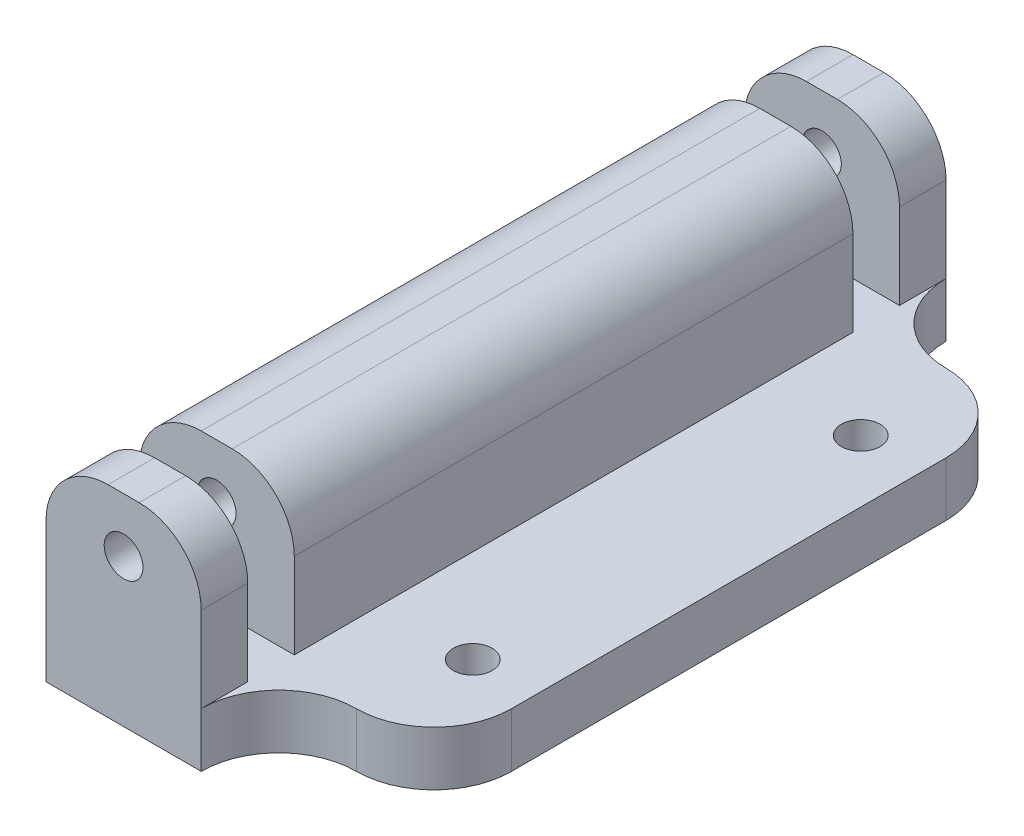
SolidWorks part; units mm, degrees
ref_plane "前视基准面" through (0, 0, 0) normal (0, 0, 1) x (1, 0, 0)
ref_plane "上视基准面" through (0, 0, 0) normal (0, 1, 0) x (1, 0, 0)
ref_plane "右视基准面" through (0, 0, 0) normal (1, 0, 0) x (0, 0, -1)
sketch "草图1" plane through (0, 0, 0) normal (0, 0, 1) x (1, 0, 0)
  line L0 (20, 3.5) -> (10, 3.5)
  line L1 (0, 0) -> (20, 0)
  line L2 (6, 13) -> (4, 13)
  line L3 (10, 3.5) -> (10, 9)
  line L4 (20, 0) -> (20, 3.5)
  line L5 (0, 9) -> (0, 0)
  arc A0 (0, 9) -> (4, 13) centre (4, 9) cw
  arc A1 (6, 13) -> (10, 9) centre (6, 9) cw
  point P10 (0, 13)
  dimension "D5" = 4
  dimension "D1" = 3.5
  dimension "D2" = 20
  dimension "D3" = 13
  dimension "D4" = 10
extrude "凸台-拉伸1" add sketch "草图1" along normal blind 48
sketch "草图3" plane through (0, 0, 0) normal (0, 0, -1) x (-1, 0, 0)
  line L0 (-6, 13) -> (-4, 13) construction
  circle A0 centre (-5, 9.5) radius 1
  dimension "D1" = 3.5
  dimension "D2" = 2
extrude "切除-拉伸2" cut sketch "草图3" against normal blind 60
sketch "草图4" plane through (0, 3.5, 0) normal (0, 1, 0) x (1, 0, 0)
  line L0 (20, -24) -> (10, -24) construction
  line L1 (20, -48) -> (20, 0) construction
  line L2 (10, -48) -> (10, 0) construction
  circle A0 centre (16, -11.5) radius 1
  circle A1 centre (16, -36.5) radius 1
  dimension "D1" = 2
  dimension "D2" = 4
  dimension "D3" = 25
extrude "切除-拉伸3" cut sketch "草图4" against normal blind 60
sketch "草图5" plane through (0, 3.5, 0) normal (0, 1, 0) x (1, 0, 0)
  line L0 (10, -24) -> (20, -24) construction
  line L1 (10, -48) -> (10, 0) construction
  line L2 (20, -48) -> (20, 0) construction
  line L3 (20, 0) -> (20, -5)
  line L4 (10, -48) -> (20, -48)
  line L5 (10, -48) -> (10, -43)
  line L6 (10, -43) -> (20, -43)
  line L7 (20, -48) -> (20, -43)
  line L8 (10, -5) -> (20, -5)
  line L9 (10, 0) -> (10, -5)
  line L10 (10, 0) -> (20, 0)
  dimension "D1" = 5
extrude "切除-拉伸4" cut sketch "草图5" against normal blind 60
fillet "圆角1" radius 5 4 edges at (20, 1.75, 43) (10, 1.75, 43) (20, 1.75, 5) (10, 1.75, 5)
sketch "草图6" plane through (0, 0, 0) normal (-1, 0, 0) x (0, 0, 1)
  line L0 (24, 0) -> (24, 13) construction
  line L1 (48, 0) -> (0, 0) construction
  line L2 (48, 13) -> (0, 13) construction
  line L3 (0, 9) -> (0, 0) construction
  line L4 (3, 13) -> (6, 13)
  line L5 (3, 13) -> (3, 3.5)
  line L6 (3, 3.5) -> (6, 3.5)
  line L7 (6, 13) -> (6, 3.5)
  line L8 (42, 13) -> (42, 3.5)
  line L9 (45, 3.5) -> (42, 3.5)
  line L10 (45, 13) -> (45, 3.5)
  line L11 (45, 13) -> (42, 13)
  dimension "D1" = 3
  dimension "D2" = 3
  dimension "D3" = 9.5
extrude "切除-拉伸5" cut sketch "草图6" against normal blind 60
hole_wizard "M3 螺纹孔1" positions "草图7" profile "草图8" tap size "M3" standard "GB"
sketch "草图7" plane through (0, 0, 0) normal (0, 0, -1) x (-1, 0, 0)
  point P0 (-5, 9.5)
sketch "草图8" plane through (5, 9.5, 0) normal (1, 0, 0) x (0, 1, 0)
  line L0 (0, 0) -> (0, 15)
  line L1 (0, 15) -> (1.25, 15)
  line L2 (1.25, 15) -> (1.25, 0)
  line L5 (1.25, 0) -> (0, 0)
  line L10 (0, 15) -> (-1.25, 15) construction
  line L11 (0, -6.35) -> (0, 107.95) construction
  dimension "螺纹孔钻头直径" = 2.5
  dimension "螺纹孔钻头深度" = 15
  dimension "导头角度" = 180
hole_wizard "M3 螺纹孔2" positions "草图9" profile "草图10" tap size "M3" standard "GB"
sketch "草图9" plane through (0, 0, 48) normal (0, 0, 1) x (1, 0, 0)
  point P0 (5, 9.5)
sketch "草图10" plane through (5, 9.5, 48) normal (1, 0, 0) x (0, -1, 0)
  line L0 (0, 0) -> (0, 15)
  line L1 (0, 15) -> (1.25, 15)
  line L2 (1.25, 15) -> (1.25, 0)
  line L5 (1.25, 0) -> (0, 0)
  line L10 (0, 15) -> (-1.25, 15) construction
  line L11 (0, -6.35) -> (0, 107.95) construction
  dimension "螺纹孔钻头直径" = 2.5
  dimension "螺纹孔钻头深度" = 15
  dimension "导头角度" = 180
hole_wizard "M3 螺纹孔3" positions "草图11" profile "草图12" tap size "M3" standard "GB"
sketch "草图11" plane through (0, 3.5, 0) normal (0, 1, 0) x (1, 0, 0)
  point P0 (16, -36.5)
  point P3 (16, -11.5)
sketch "草图12" plane through (16, 3.5, 36.5) normal (1, 0, 0) x (0, 0, 1)
  line L0 (0, 0) -> (0, 3.499)
  line L1 (0, 3.499) -> (1.25, 3.499)
  line L2 (1.25, 3.499) -> (1.25, 0)
  line L5 (1.25, 0) -> (0, 0)
  line L10 (0, 3.499) -> (-1.25, 3.499) construction
  line L11 (0, -6.35) -> (0, 107.95) construction
  dimension "螺纹孔钻头直径" = 2.5
  dimension "螺纹孔钻头深度" = 3.499
  dimension "导头角度" = 180
